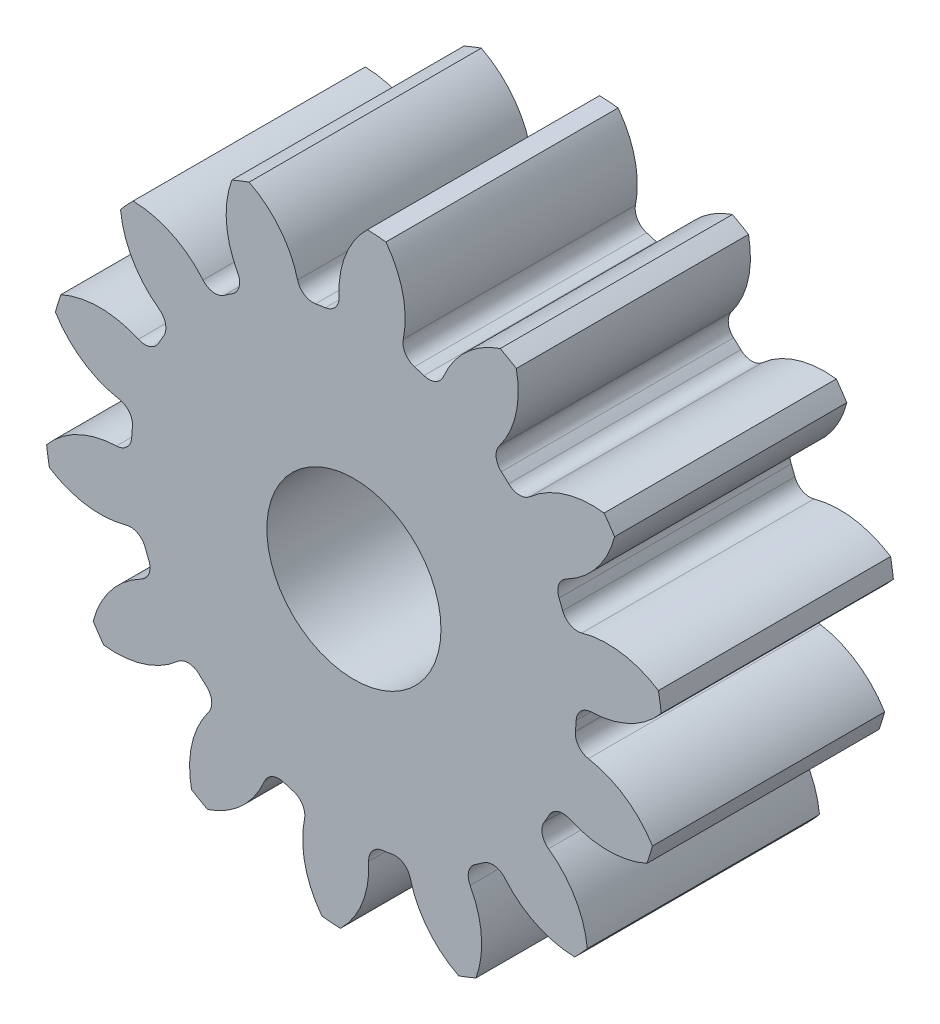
SolidWorks part; units mm, degrees
ref_plane "Front" through (0, 0, 0) normal (0, 0, 1) x (1, 0, 0)
ref_plane "Top" through (0, 0, 0) normal (0, 1, 0) x (1, 0, 0)
ref_plane "Right" through (0, 0, 0) normal (1, 0, 0) x (0, 0, -1)
sketch "Sketch3" plane through (0, 0, 0) normal (0, 0, 1) x (1, 0, 0)
  circle A0 centre (0, 0) radius 135.4667
  dimension "od" = 270.9333
extrude "gearBody" add sketch "Sketch3" along normal blind 101.6
sketch "Sketch2" plane through (0, 0, 0) normal (0, 0, 1) x (1, 0, 0)
  line L0 (0, 0) -> (102.9062, 42.6252) construction
  line L1 (131.4294, -37.2308) -> (0, 0) construction
  line L2 (0, 0) -> (36.3143, 0) construction
  line L3 (118.4444, 4.5901) -> (116.4928, -21.8994) construction
  line L5 (117.4686, -8.6547) -> (0, 0) construction
  line L7 (0, 0) -> (111.3849, 0) construction
  arc A0 (111.3587, 2.4175) -> (109.8019, -18.7118) centre (0, 0) ccw construction
  arc A1 (134.4785, 16.3327) -> (130.6327, -35.8651) centre (0, 0) ccw construction
  arc A2 (118.4444, 4.5901) -> (116.4928, -21.8994) centre (0, 0) ccw construction
  arc A3 (96.9196, -9.32) -> (97.239, -4.9849) centre (0, 0) ccw
  arc A4 (131.4294, -37.2308) -> (102.5974, -16.7693) centre (95.548, -57.2465) ccw
  arc A5 (131.4294, -37.2308) -> (135.4667, 17.5669) centre (0, 0) ccw
  arc A6 (135.4667, 17.5669) -> (103.9472, 1.5519) centre (102.9062, 42.6252) cw
  arc A7 (97.239, -4.9849) -> (103.9472, 1.5519) centre (104.1218, -5.3378) cw
  arc A8 (102.5974, -16.7693) -> (96.9196, -9.32) centre (103.7798, -9.9796) cw
  point P6 (135.4667, 17.5669)
  point P22 (131.4294, -37.2308)
  dimension "baseDia" = 222.7698
  dimension "od" = 270.9333
  dimension "pd" = 237.0667
  dimension "rd" = 194.7333
  dimension "rFillet" = 6.8919
  dimension "pointX" = 135.4667
  dimension "pointY" = 17.5669
  dimension "CTT" = 26.4896
  dimension "flankCenterAngle" = 22.5
extrude "toothCut" cut sketch "Sketch2" along normal through all
pattern_circular "CirPattern1" count 14 over 360 about axis through (0, 0, 0) along (0, 0, 1) of "toothCut"
sketch "hub1Dia" plane through (0, 0, 0) normal (0, 0, -1) x (-1, 0, 0)
  circle A0 centre (0, 0) radius 12.7
  dimension "hub1Dia" = 25.4
sketch "hub2Dia" plane through (0, 0, 101.6) normal (0, 0, 1) x (1, 0, 0)
  circle A0 centre (0, 0) radius 12.7
  dimension "hub2dia" = 25.4
sketch "boreDia" plane through (0, 0, 0) normal (0, 0, 1) x (1, 0, 0)
  circle A0 centre (0, 0) radius 38.1
  dimension "boreDia" = 76.2
extrude "bore" cut sketch "boreDia" against normal mid plane 25400
